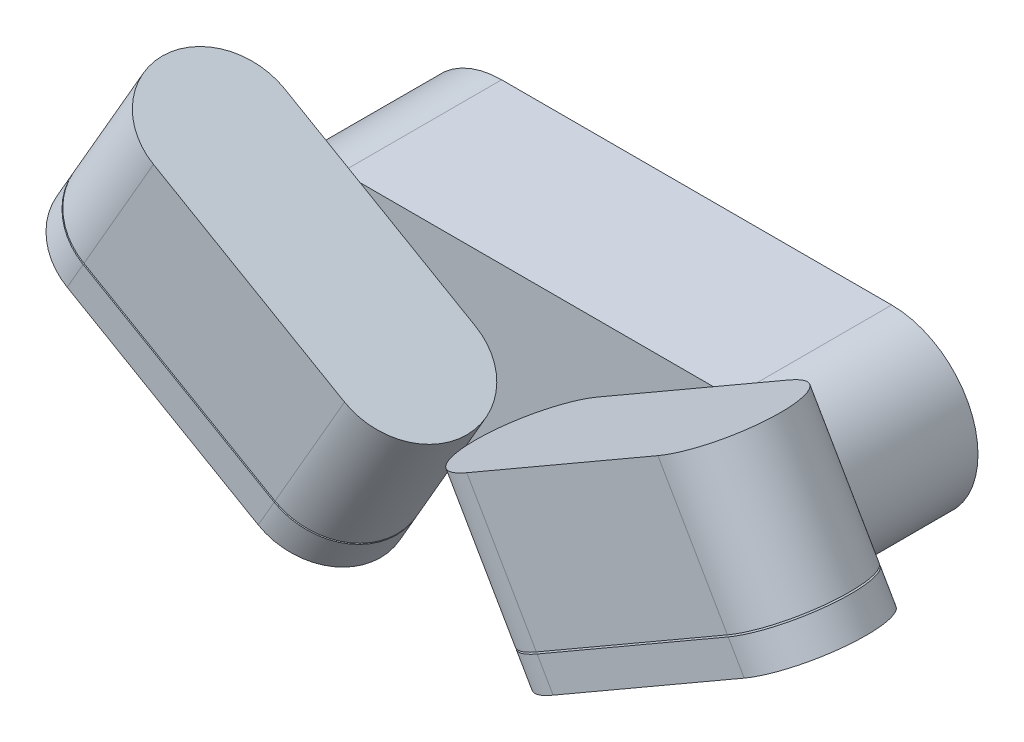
SolidWorks part; units mm, degrees
ref_plane "Alzado" through (0, 0, 0) normal (0, 0, 1) x (1, 0, 0)
ref_plane "Planta" through (0, 0, 0) normal (0, 1, 0) x (1, 0, 0)
ref_plane "Vista lateral" through (0, 0, 0) normal (1, 0, 0) x (0, 0, -1)
sketch "Croquis1" plane through (0, 0, 0) normal (0, 0, 1) x (1, 0, 0)
  line L0 (88, 0) -> (-88, 0) construction
  line L1 (0, -27) -> (0, 27) construction
  line L3 (-61, -27) -> (61, -27)
  line L5 (-61, 27) -> (61, 27)
  arc A0 (-61, 27) -> (-61, -27) centre (-61, 0) ccw
  arc A1 (61, 27) -> (61, -27) centre (61, 0) cw
  point P4 (0, 0)
  point P8 (0, 0)
  point P9 (0, 0)
  dimension "D5" = 54
  dimension "D1" = 27
  dimension "D2" = 122
  dimension "D3" = 88
  dimension "D4" = 27
extrude "Saliente-Extruir1" add sketch "Croquis1" along normal blind 50
sketch "Croquis2" plane through (0, 0, 50) normal (0, 0, 1) x (1, 0, 0)
  line L0 (-62.5, 0) -> (0, 0) construction
  line L1 (-123.6314, 4.1173) -> (-96.6314, 50.8827)
  line L3 (-14.8686, -27.5) -> (-110.1314, 27.5) construction
  line L4 (-49, 23.3827) -> (-76, -23.3827) construction
  line L5 (-1.3686, -4.1173) -> (-96.6314, 50.8827)
  line L6 (-28.3686, -50.8827) -> (-123.6314, 4.1173)
  line L7 (-96.6314, 50.8827) -> (-123.6314, 4.1173)
  line L8 (-1.3686, -4.1173) -> (-28.3686, -50.8827)
  point P4 (0, 0)
  point P10 (-62.5, 0)
  point P13 (-62.5, 0)
  dimension "D8" = 150
  dimension "D1" = 62.5
  dimension "D2" = 54
  dimension "D3" = 110
  dimension "D4" = 27
  dimension "D6" = 55
  dimension "D7" = 55
extrude "Saliente-Extruir3" add sketch "Croquis2" along normal blind 41 contours L8 L5 L1 L6 M13 M12 M15 | L8 L5 M15 M12 M13
sketch "Croquis3" plane through (-29.125, -50.446, 0) normal (-0.5, -0.866, 0) x (0.866, -0.5, 0)
  line L0 (-109.1266, 70.5) -> (0.8734, 70.5) construction
  line L1 (-109.1266, 91) -> (-109.1266, 50) construction
  line L2 (0.8734, 91) -> (0.8734, 50) construction
  line L3 (0.8734, 91) -> (-109.1266, 91) construction
  line L4 (-88.6266, 91) -> (-109.1266, 91)
  line L5 (-109.1266, 91) -> (-109.1266, 50)
  line L6 (-109.1266, 50) -> (-88.6266, 50)
  line L7 (-19.6266, 91) -> (0.8734, 91)
  line L8 (0.8734, 91) -> (0.8734, 50)
  line L9 (0.8734, 50) -> (-19.6266, 50)
  arc A0 (-88.6266, 91) -> (-88.6266, 50) centre (-88.6266, 70.5) ccw
  arc A1 (-19.6266, 50) -> (-19.6266, 91) centre (-19.6266, 70.5) ccw
extrude "Cortar-Extruir1" cut sketch "Croquis3" against normal up to surface (54 mm away) contours A0 M5 M6 | A0 L5 M3 | A1 L8 M5 | A1 M3 M4
ref_plane "Plano1" through (-24.125, -41.7857, 0) normal (-0.5, -0.866, 0) x (-0.866, 0.5, 0)
sketch "Croquis4" plane through (-24.125, -41.7857, 0) normal (-0.5, -0.866, 0) x (-0.866, 0.5, 0)
  line L4 (19.6266, -86) -> (88.6266, -86)
  line L5 (88.6266, -55) -> (19.6266, -55)
  line L6 (19.6266, -86) -> (88.6266, -86)
  line L7 (88.6266, -55) -> (19.6266, -55)
  line L10 (19.6266, -91) -> (88.6266, -91)
  line L11 (88.6266, -50) -> (19.6266, -50)
  line L12 (19.6266, -91) -> (88.6266, -91)
  line L13 (88.6266, -50) -> (19.6266, -50)
  arc A4 (88.6266, -86) -> (88.6266, -55) centre (88.6266, -70.5) ccw
  arc A5 (19.6266, -55) -> (19.6266, -86) centre (19.6266, -70.5) ccw
  arc A6 (88.6266, -86) -> (88.6266, -55) centre (88.6266, -70.5) ccw
  arc A7 (19.6266, -55) -> (19.6266, -86) centre (19.6266, -70.5) ccw
  arc A10 (88.6266, -91) -> (88.6266, -50) centre (88.6266, -70.5) ccw
  arc A11 (19.6266, -50) -> (19.6266, -91) centre (19.6266, -70.5) ccw
  arc A12 (88.6266, -91) -> (88.6266, -50) centre (88.6266, -70.5) ccw
  arc A13 (19.6266, -50) -> (19.6266, -91) centre (19.6266, -70.5) ccw
  dimension "D1" = 5
  dimension "D2" = 0
extrude "Cortar-Extruir2" cut sketch "Croquis4" against normal blind 0.5
mirror "Simetría3" about plane through (0, 0, 0) normal (1, 0, 0) of "Cortar-Extruir1", "Saliente-Extruir3"
mirror "Simetría4" about plane through (0, 0, 0) normal (1, 0, 0) of "Cortar-Extruir2"
